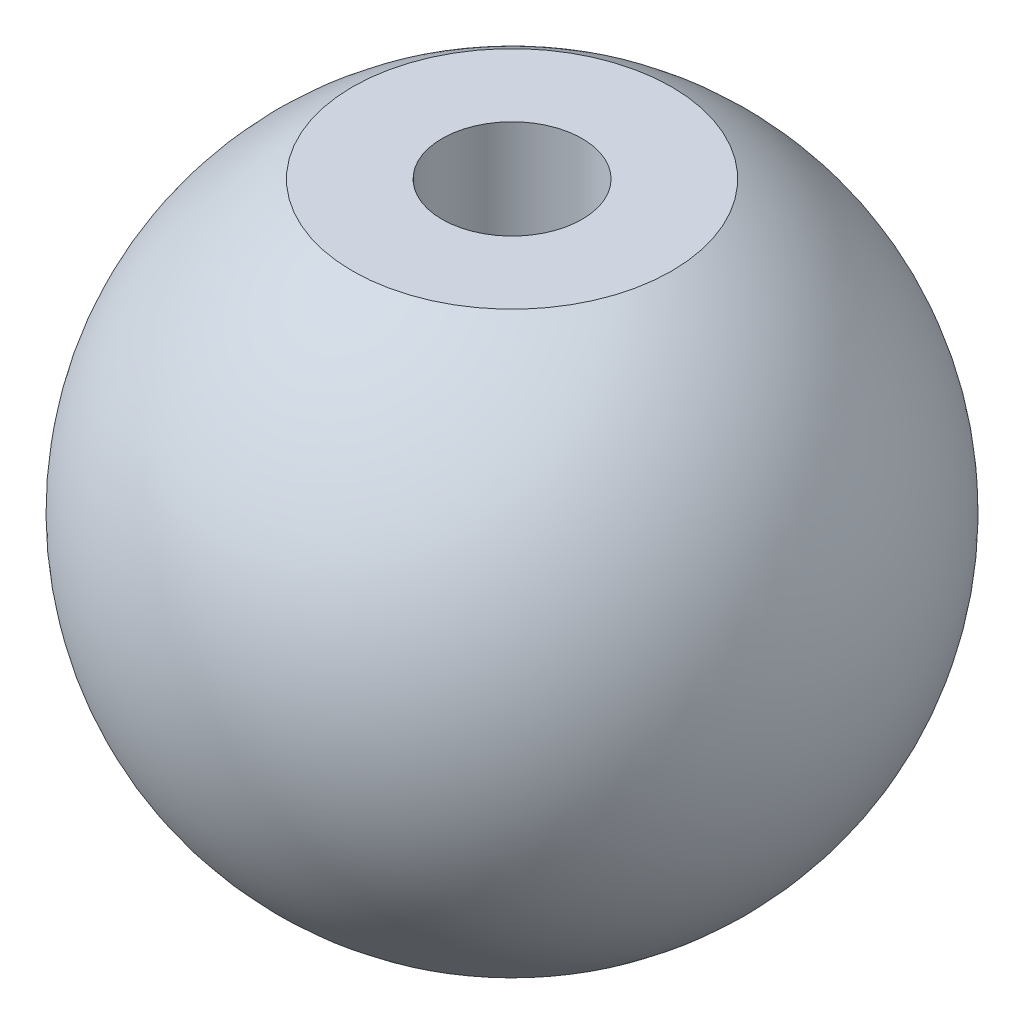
SolidWorks part; units mm, degrees
ref_plane "Plan de face" through (0, 0, 0) normal (0, 0, 1) x (1, 0, 0)
ref_plane "Plan de dessus" through (0, 0, 0) normal (0, 1, 0) x (1, 0, 0)
ref_plane "Plan de droite" through (0, 0, 0) normal (1, 0, 0) x (0, 0, -1)
sketch "Esquisse1" plane through (0, 0, 0) normal (0, 0, 1) x (1, 0, 0)
  line L0 (0, 26.2348) -> (0, -31.417) construction
  line L1 (-7.746, 14) -> (0, 14)
  line L2 (0, 14) -> (0, -16)
  arc A0 (0, -16) -> (-7.746, 14) centre (0, 0) cw
  dimension "D1" = 16
  dimension "D2" = 30
revolve "Révolution1" add sketch "Esquisse1" angle 360 about L0
hole_wizard "Trou taraudé M81" positions "Esquisse3" profile "Esquisse2" tap size "M8" standard "ISO"
sketch "Esquisse3" plane through (0, 14, 0) normal (0, 1, 0) x (1, 0, 0)
  point P0 (0, 0)
sketch "Esquisse2" plane through (0, 14, 0) normal (1, 0, 0) x (0, 0, 1)
  line L0 (0, 0) -> (0, 24.2929)
  line L1 (0, 24.2929) -> (3.4, 22.25)
  line L2 (3.4, 22.25) -> (3.4, 0)
  line L5 (3.4, 0) -> (0, 0)
  line L10 (0, 24.2929) -> (-3.4, 22.25) construction
  line L11 (0, -6.35) -> (0, 107.95) construction
  dimension "Diamètre du trou pour taraudage" = 6.8
  dimension "Profondeur du trou pour taraudage" = 22.25
  dimension "Angle de pointe" = 118
